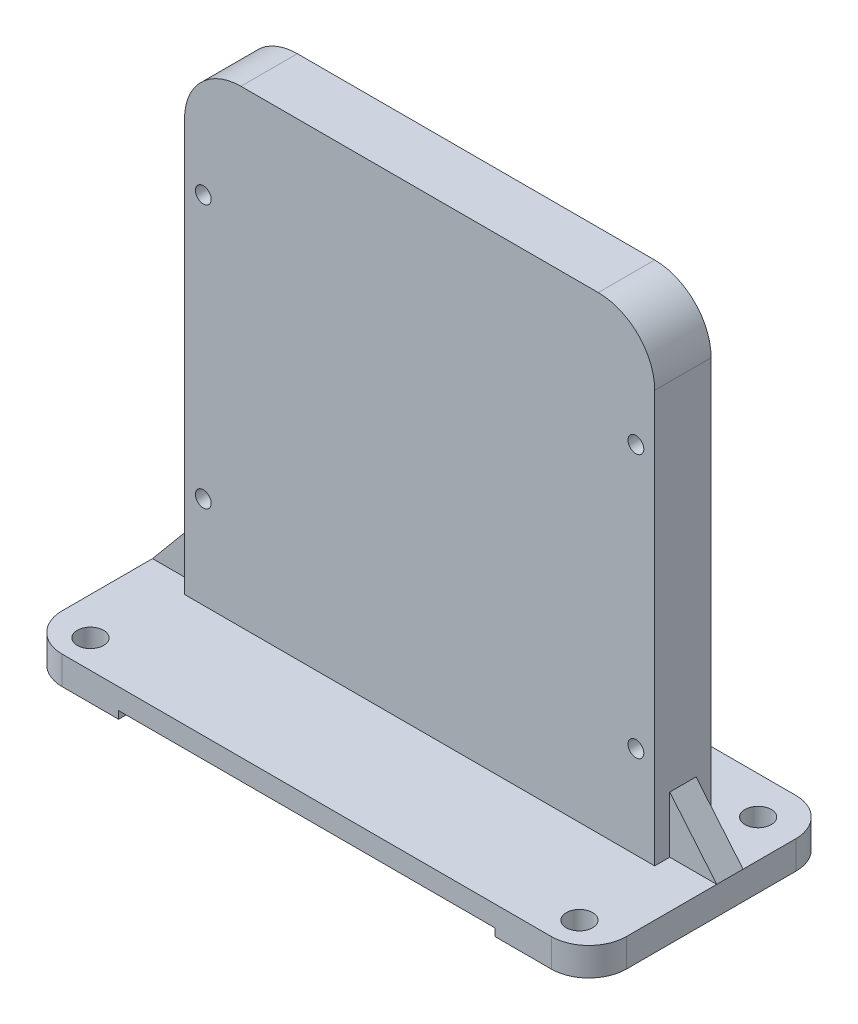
SolidWorks part; units mm, degrees
ref_plane "前视基准面" through (0, 0, 0) normal (0, 0, 1) x (1, 0, 0)
ref_plane "上视基准面" through (0, 0, 0) normal (0, 1, 0) x (1, 0, 0)
ref_plane "右视基准面" through (0, 0, 0) normal (1, 0, 0) x (0, 0, -1)
sketch "草图1" plane through (0, 0, 0) normal (0, 0, 1) x (1, 0, 0)
  line L1 (47.5, 66) -> (-47.5, 66)
  line L2 (62.5, 51) -> (62.5, -66)
  line L3 (62.5, -66) -> (-62.5, -66)
  line L4 (-62.5, 51) -> (-62.5, -66)
  line L5 (62.5, 66) -> (-62.5, -66) construction
  line L6 (62.5, -66) -> (-62.5, 66) construction
  arc A0 (47.5, 66) -> (62.5, 51) centre (47.5, 51) cw
  arc A1 (-47.5, 66) -> (-62.5, 51) centre (-47.5, 51) ccw
  point P0 (0, 0)
  dimension "D3" = 15
  dimension "D1" = 132
  dimension "D2" = 125
extrude "凸台-拉伸1" add sketch "草图1" along normal mid plane 15
sketch "草图2" plane through (0, -66, 0) normal (0, -1, 0) x (1, 0, 0)
  line L1 (75, 37.5) -> (-75, 37.5)
  line L2 (75, 37.5) -> (75, -27.5)
  line L3 (75, -27.5) -> (-75, -27.5)
  line L4 (-75, 37.5) -> (-75, -27.5)
  line L5 (75, 37.5) -> (-75, -27.5) construction
  line L6 (75, -27.5) -> (-75, 37.5) construction
  line L8 (-62.5, 7.5) -> (62.5, 7.5) construction
  line L9 (-62.5, -7.5) -> (62.5, -7.5) construction
  line L10 (0, 5) -> (0, 0) construction
  point P0 (0, 5)
  dimension "D1" = 30
  dimension "D2" = 20
  dimension "D3" = 150
extrude "凸台-拉伸2" add sketch "草图2" against normal blind 7.5
sketch "草图3" plane through (0, 0, 0) normal (0, 0, 1) x (1, 0, 0)
  line L0 (-75, -58.5) -> (-62.5, -43.5)
  line L1 (-62.5, 51) -> (-62.5, -58.5) construction
  line L2 (75, -58.5) -> (-75, -58.5) construction
  dimension "D1" = 15
rib "筋1" sketch "草图3" sketch "草图3" thickness 7 extrusion direction parallel to sketch draft on no parameters "D1"=7
mirror "镜向1" about plane through (0, 0, 0) normal (1, 0, 0) of "筋1"
sketch "草图4" plane through (0, -58.5, 0) normal (0, 1, 0) x (1, 0, 0)
  line L0 (-65, 17.5) -> (-65, -30) construction
  line L1 (-75, 27.5) -> (75, 27.5) construction
  line L2 (75, -37.5) -> (-75, -37.5) construction
  dimension "D1" = 65
  dimension "D2" = 10
  dimension "D3" = 7.5
hole_wizard "M8x1.0 螺纹孔1" positions "3D草图1" profile "草图5" tap size "M8x1.0" standard "GB"
sketch3d "3D草图1"
  point P0 (-65, -58.5, -17.5)
  point P3 (-65, -58.5, 30)
sketch "草图5" plane through (-65, -58.5, -17.5) normal (1, 0, 0) x (0, 0, 1)
  line L0 (0, 0) -> (0, 21.103)
  line L1 (0, 21.103) -> (3.5, 19)
  line L2 (3.5, 19) -> (3.5, 0)
  line L5 (3.5, 0) -> (0, 0)
  line L10 (0, 21.103) -> (-3.5, 19) construction
  line L11 (0, -6.35) -> (0, 107.95) construction
  dimension "螺纹孔钻头直径" = 7
  dimension "螺纹孔钻头深度" = 19
  dimension "导头角度" = 118
mirror "镜向2" about plane through (0, 0, 0) normal (1, 0, 0) of "M8x1.0 螺纹孔1"
fillet "圆角1" radius 10 4 edges at (75, -62.25, -27.5) (75, -62.25, 37.5) (-75, -62.25, -27.5) (-75, -62.25, 37.5)
sketch "草图6" plane through (0, 0, 7.5) normal (0, 0, 1) x (1, 0, 0)
  line L0 (-62.5, 51) -> (-62.5, -58.5) construction
  line L1 (57.5, 41) -> (-57.5, 41)
  line L2 (62.5, 36) -> (62.5, -34)
  line L3 (57.5, -39) -> (-57.5, -39)
  line L4 (-62.5, 36) -> (-62.5, -34)
  line L5 (62.5, 41) -> (-62.5, -39) construction
  line L6 (62.5, -39) -> (-62.5, 41) construction
  line L7 (47.5, 66) -> (-47.5, 66) construction
  arc A0 (57.5, 41) -> (62.5, 36) centre (57.5, 36) cw
  arc A1 (62.5, -34) -> (57.5, -39) centre (57.5, -34) cw
  arc A2 (-57.5, -39) -> (-62.5, -34) centre (-57.5, -34) cw
  arc A3 (-57.5, 41) -> (-62.5, 36) centre (-57.5, 36) ccw
  point P0 (0, 1)
  dimension "D3" = 5
  dimension "D1" = 65
  dimension "D2" = 80
  dimension "D4" = 125
hole_wizard "M5 螺纹孔1" positions "3D草图2" profile "草图8" tap size "M5" standard "GB"
sketch3d "3D草图2"
  point P0 (-57.5, 36, 7.5)
  point P4 (57.5, 36, 7.5)
  point P7 (57.5, -34, 7.5)
  point P10 (-57.5, -34, 7.5)
sketch "草图8" plane through (-57.5, 36, 7.5) normal (1, 0, 0) x (0, -1, 0)
  line L0 (0, 0) -> (0, 35)
  line L1 (0, 35) -> (2.1, 35)
  line L2 (2.1, 35) -> (2.1, 0)
  line L5 (2.1, 0) -> (0, 0)
  line L11 (0, -6.35) -> (0, 107.95) construction
  dimension "通孔螺纹孔钻头直径" = 4.2
  dimension "通孔螺纹孔钻头深度" = 35
sketch "草图9" plane through (0, 0, 37.5) normal (0, 0, 1) x (1, 0, 0)
  line L0 (65, -66) -> (-65, -66) construction
  line L1 (50, -64) -> (-50, -64)
  line L2 (50, -64) -> (50, -68)
  line L3 (50, -68) -> (-50, -68)
  line L4 (-50, -64) -> (-50, -68)
  line L5 (50, -64) -> (-50, -68) construction
  line L6 (50, -68) -> (-50, -64) construction
  point P0 (0, -66)
  dimension "D1" = 100
  dimension "D2" = 4
extrude "切除-拉伸1" cut sketch "草图9" against normal through all
